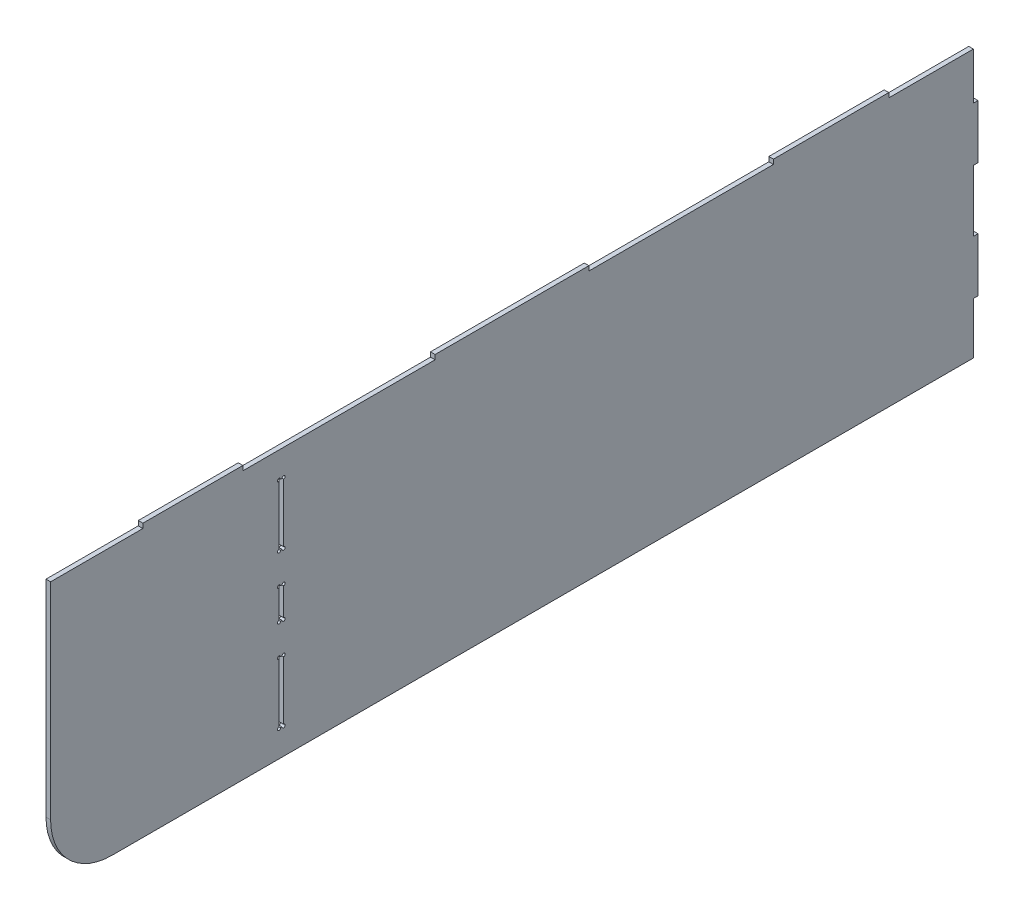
SolidWorks part; units mm, degrees
ref_plane "Front Plane" through (0, 0, 0) normal (0, 0, 1) x (1, 0, 0)
ref_plane "Top Plane" through (0, 0, 0) normal (0, 1, 0) x (1, 0, 0)
ref_plane "Right Plane" through (0, 0, 0) normal (1, 0, 0) x (0, 0, -1)
sketch "Sketch1" plane through (0, 0, 0) normal (0, 0, 1) x (1, 0, 0)
  line L2 (-598, 107) -> (-598, 168) construction
  line L5 (-598, -113) -> (-598, -180) construction
  line L10 (-598, 168) -> (-598, 174)
  line L14 (-604, 107) -> (-598, 107)
  line L15 (-604, 107) -> (-604, 37)
  line L16 (-604, 37) -> (-598, 37)
  line L17 (-598, 107) -> (-598, 37)
  line L18 (-604, -43) -> (-598, -43)
  line L19 (-604, -43) -> (-604, -113)
  line L20 (-604, -113) -> (-598, -113)
  line L21 (-598, -43) -> (-598, -113)
  line L74 (-598, 174) -> (-604, 174)
  line L75 (-598, 174) -> (-598, -180)
  line L76 (-598, -180) -> (-604, -180)
  line L77 (-604, 174) -> (-604, -180)
extrude "Boss-Extrude1" add sketch "Sketch1" along normal blind 1200 contours L74 L77 L14 L75 L10 | L16 L77 L18 L75 | L20 L77 L76 L75
sketch "Sketch2" plane through (-604, 0, 0) normal (-1, 0, 0) x (0, 0, 1)
  line L1 (0, 107) -> (-6, 107)
  line L2 (0, 107) -> (0, 37)
  line L3 (0, 37) -> (-6, 37)
  line L4 (-6, 107) -> (-6, 37)
  line L5 (0, -43) -> (-6, -43)
  line L6 (0, -43) -> (0, -113)
  line L7 (0, -113) -> (-6, -113)
  line L8 (-6, -43) -> (-6, -113)
  line L9 (0, 174) -> (1200, 174)
  line L10 (0, 174) -> (0, -180)
  line L11 (0, -180) -> (1200, -180)
  line L12 (1200, 174) -> (1200, -180)
  dimension "D1" = 6
  dimension "D2" = 6
extrude "Boss-Extrude2" add sketch "Sketch2" against normal up to surface (6 mm away) contours L5 L8 L7 L6 | L1 L4 L3 L2 | L12 L2 L10 L6 L11 M8
sketch "Sketch3" plane through (0, 0, 1200) normal (0, 0, 1) x (1, 0, 0)
  line L0 (-598, 174) -> (-598, -180) construction
  line L1 (-604, 174) -> (-598, 174)
  line L2 (-604, 174) -> (-604, 168)
  line L3 (-604, 168) -> (-598, 168)
  line L4 (-598, 174) -> (-598, 168)
  line L5 (-1476, 168) -> (-256, 168) construction
extrude "Cut-Extrude1" cut sketch "Sketch3" against normal blind 1666
sketch "Sketch4" plane through (-604, 0, 0) normal (-1, 0, 0) x (0, 0, 1)
  line L0 (900, 168) -> (900, -180) construction
  line L1 (0, 168) -> (1200, 168) construction
  line L2 (0, -180) -> (1200, -180) construction
  line L4 (899, 134) -> (901, 134)
  line L5 (897, 132) -> (897, 56)
  line L6 (899, 54) -> (901, 54)
  line L7 (903, 132) -> (903, 56)
  line L8 (897, -66) -> (903, -66)
  line L9 (897, -66) -> (897, -146)
  line L10 (897, -146) -> (903, -146)
  line L11 (903, -66) -> (903, -146)
  circle A0 centre (897, -66) radius 2
  circle A1 centre (903, -66) radius 2
  circle A2 centre (903, -146) radius 2
  circle A3 centre (897, -146) radius 2
  arc A4 (901, 54) -> (903, 56) centre (903, 54) ccw
  arc A5 (897, 56) -> (899, 54) centre (897, 54) ccw
  arc A6 (903, 132) -> (901, 134) centre (903, 134) ccw
  arc A7 (899, 134) -> (897, 132) centre (897, 134) ccw
extrude "Cut-Extrude2" cut sketch "Sketch4" against normal blind 151 contours L10 A2 L11 | L9 A3 L10 | L11 A1 L8 | L8 A0 L9 | L4 L0 L6 A4 L7 A6 | L0 L4 A7 L5 A5 L6
fillet "Fillet1" radius 80 1 edges at (-601, -180, 1200)
sketch "Sketch5" plane through (-604, 0, 0) normal (-1, 0, 0) x (0, 0, 1)
  line L0 (0, 168) -> (1200, 168) construction
  line L1 (500, 162) -> (700, 162)
  line L2 (500, 162) -> (500, 174)
  line L3 (500, 174) -> (700, 174)
  line L4 (700, 162) -> (700, 174)
  line L5 (500, 162) -> (700, 174) construction
  line L6 (500, 174) -> (700, 162) construction
  line L8 (110, 162) -> (260, 162)
  line L9 (110, 162) -> (110, 174)
  line L10 (110, 174) -> (260, 174)
  line L11 (260, 162) -> (260, 174)
  line L12 (110, 162) -> (260, 174) construction
  line L13 (110, 174) -> (260, 162) construction
  line L14 (950, 162) -> (1080, 162)
  line L15 (950, 162) -> (950, 174)
  line L16 (950, 174) -> (1080, 174)
  line L17 (1080, 162) -> (1080, 174)
  line L18 (950, 162) -> (1080, 174) construction
  line L19 (950, 174) -> (1080, 162) construction
  point P0 (600, 168)
  point P7 (185, 168)
  point P12 (1015, 168)
  point P17 (950, 168)
  point P18 (260, 168)
  dimension "D1" = 200
  dimension "D2" = 12
  dimension "D3" = 150
  dimension "D4" = 12
  dimension "D5" = 130
  dimension "D6" = 12
  dimension "D7" = 250
  dimension "D8" = 240
extrude "Boss-Extrude3" add sketch "Sketch5" against normal up to surface (6 mm away)
sketch "Sketch6" plane through (-598, 0, 0) normal (1, 0, 0) x (0, 0, -1)
  line L1 (-901, 14) -> (-899, 14)
  line L2 (-903, 12) -> (-903, -24)
  line L3 (-901, -26) -> (-899, -26)
  line L4 (-897, 12) -> (-897, -24)
  arc A0 (-901, 14) -> (-903, 12) centre (-903, 14) ccw
  arc A1 (-897, 12) -> (-899, 14) centre (-897, 14) ccw
  arc A2 (-899, -26) -> (-897, -24) centre (-897, -26) ccw
  arc A3 (-903, -24) -> (-901, -26) centre (-903, -26) ccw
  dimension "D1" = 4
  dimension "D2" = 4
  dimension "D3" = 4
  dimension "D4" = 4
extrude "Cut-Extrude3" cut sketch "Sketch6" against normal mid plane 81
